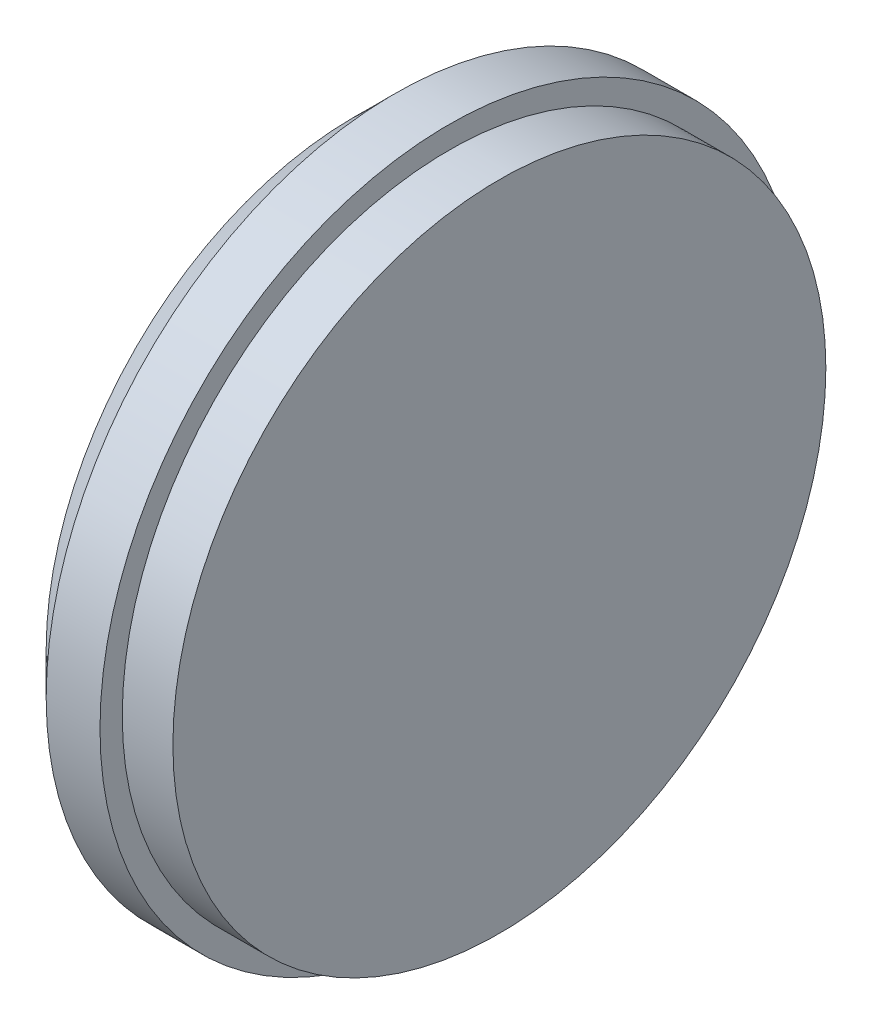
SolidWorks part; units mm, degrees
ref_plane "Front Plane" through (0, 0, 0) normal (0, 0, 1) x (1, 0, 0)
ref_plane "Top Plane" through (0, 0, 0) normal (0, 1, 0) x (1, 0, 0)
ref_plane "Right Plane" through (0, 0, 0) normal (1, 0, 0) x (0, 0, -1)
sketch "Sketch1" plane through (0, 0, 0) normal (0, 0, 1) x (1, 0, 0)
  line L1 (-4.76, 38.1) -> (-4.76, -2.8448)
  line L2 (-4.76, -2.8448) -> (-11.11, -2.8448)
  line L3 (-11.11, -2.8448) -> (-11.11, -5.6388)
  line L4 (-11.11, -5.6388) -> (-17.8587, -5.6388)
  line L5 (-17.8587, -5.6388) -> (-23.0175, -0.4826)
  line L6 (-23.0175, -0.4826) -> (-23.0175, 38.1)
  line L7 (-23.0175, 38.1) -> (-4.76, 38.1)
  dimension "D3" = 6.35
  dimension "D4" = 6.7488
  dimension "D5" = 5.1587
  dimension "D6" = 38.5826
  dimension "D7" = 43.7388
revolve "Revolve1" add sketch "Sketch1" angle 360 about L7
